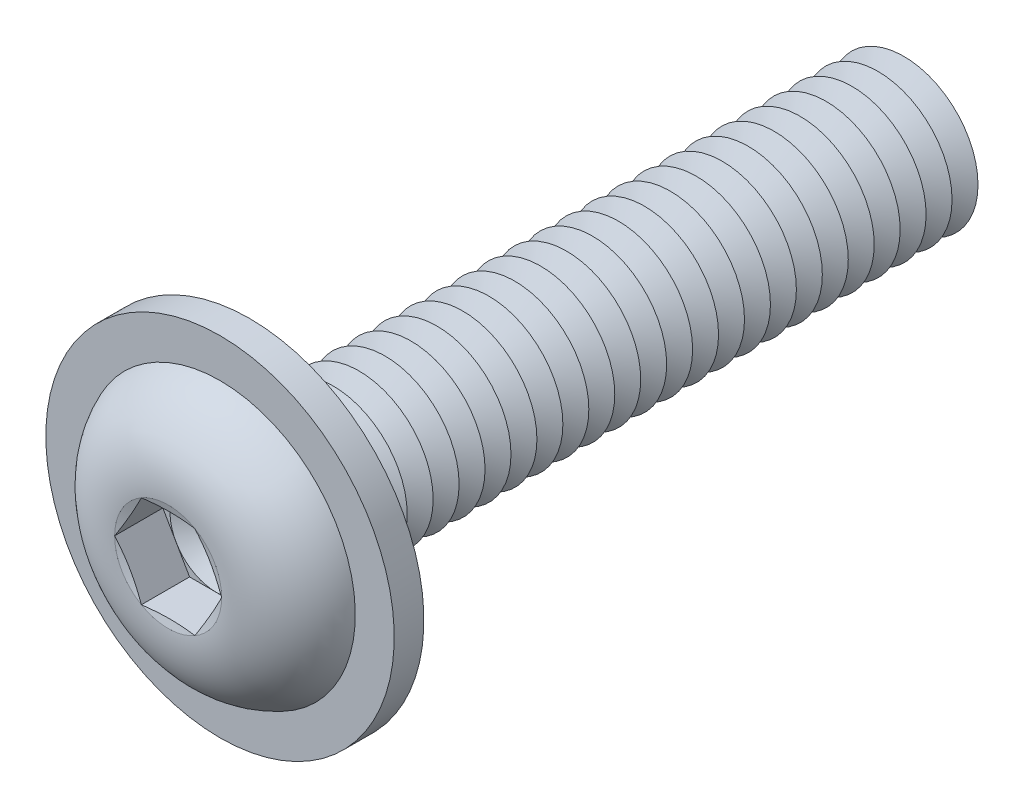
SolidWorks part; units mm, degrees
ref_plane "Front Plane" through (0, 0, 0) normal (0, 0, 1) x (1, 0, 0)
ref_plane "Top Plane" through (0, 0, 0) normal (0, 1, 0) x (1, 0, 0)
ref_plane "Right Plane" through (0, 0, 0) normal (1, 0, 0) x (0, 0, -1)
sketch "Sketch1" plane through (0, 0, 0) normal (1, 0, 0) x (0, 0, -1)
  line L0 (0, 2) -> (0, 3.8)
  line L3 (0, 2) -> (18, 2)
  line L4 (18, 2) -> (18, 0)
  line L5 (18, 0) -> (-2.2, 0) construction
  line L6 (-2.2, 0) -> (18, 0)
  line L7 (-2.2, 1.4434) -> (-2.2, 0.7217) construction
  line L8 (-2.2, 0.7217) -> (-2.2, 0)
  line L9 (-2.2, 1.4434) -> (-2.0066, 0.7217)
  line L10 (-2.0066, 0.7217) -> (-2.2, 0.7217)
  line L11 (18, 0) -> (22.7481, 0) construction
  line L12 (0, 3.8) -> (-2.2, 3.8) construction
  arc A1 (0, 3.8) -> (-2.2, 1.4434) centre (0, 1.5948) ccw
  point P8 (18, 1)
  dimension "D1" = 7.6
  dimension "D2" = 4
  dimension "D3" = 2.2
  dimension "D4" = 2.8868
  dimension "D5" = 18
  dimension "D6" = 15
revolve "Revolve1" add sketch "Sketch1" angle 360 about L5
fillet "Fillet1" radius 0.35 1 edges at (-2, 0, 0)
sketch "Sketch2" plane through (0, 0, 0) normal (1, 0, 0) x (0, 0, -1)
  line L0 (17.65, 2) -> (18.35, 2)
  line L1 (18, 2) -> (0.35, 2) construction
  line L2 (18.35, 2) -> (18, 1.3938)
  line L3 (18, -2) -> (18, 2) construction
  line L4 (18, 1.3938) -> (17.65, 2)
  dimension "D1" = 0.7
revolve "Cut-Revolve1" cut sketch "Sketch2" angle 360 about axis through (0, 0, -18) along (0, 0, -1)
pattern_linear "LPattern1" count 25 spacing 0.7 along (0, 0, 1) of "Cut-Revolve1"
sketch "Sketch3" plane through (0, 0, 2.2) normal (0, 0, 1) x (1, 0, 0)
  line L7 (0.7217, 1.25) -> (-0.7217, 1.25)
  line L8 (-0.7217, 1.25) -> (-1.4434, 0)
  line L9 (-1.4434, 0) -> (-0.7217, -1.25)
  line L10 (-0.7217, -1.25) -> (0.7217, -1.25)
  line L11 (0.7217, -1.25) -> (1.4434, 0)
  line L12 (1.4434, 0) -> (0.7217, 1.25)
  circle A0 centre (0, 0) radius 1.25 construction
  circle A3 centre (0, 0) radius 1.4434 construction
extrude "Cut-Extrude1" cut sketch "Sketch3" against normal blind 1.3
sketch "Sketch4" plane through (0, 0, 0.9) normal (0, 0, 1) x (1, 0, 0)
  line L1 (0.7217, 1.25) -> (-0.7217, 1.25) construction
  circle A0 centre (0, 0) radius 1.25
extrude "Cut-Extrude2" cut sketch "Sketch4" against normal through all draft 60
sketch "Sketch5" plane through (0, 0, 0) normal (0, 0, -1) x (-1, 0, 0)
  circle A0 centre (0, 0) radius 4.7
  circle A1 centre (0, 0) radius 2.35
  circle A2 centre (0, 0) radius 2.35 construction
  dimension "D1" = 9.4
extrude "Boss-Extrude1" add sketch "Sketch5" against normal blind 0.8
